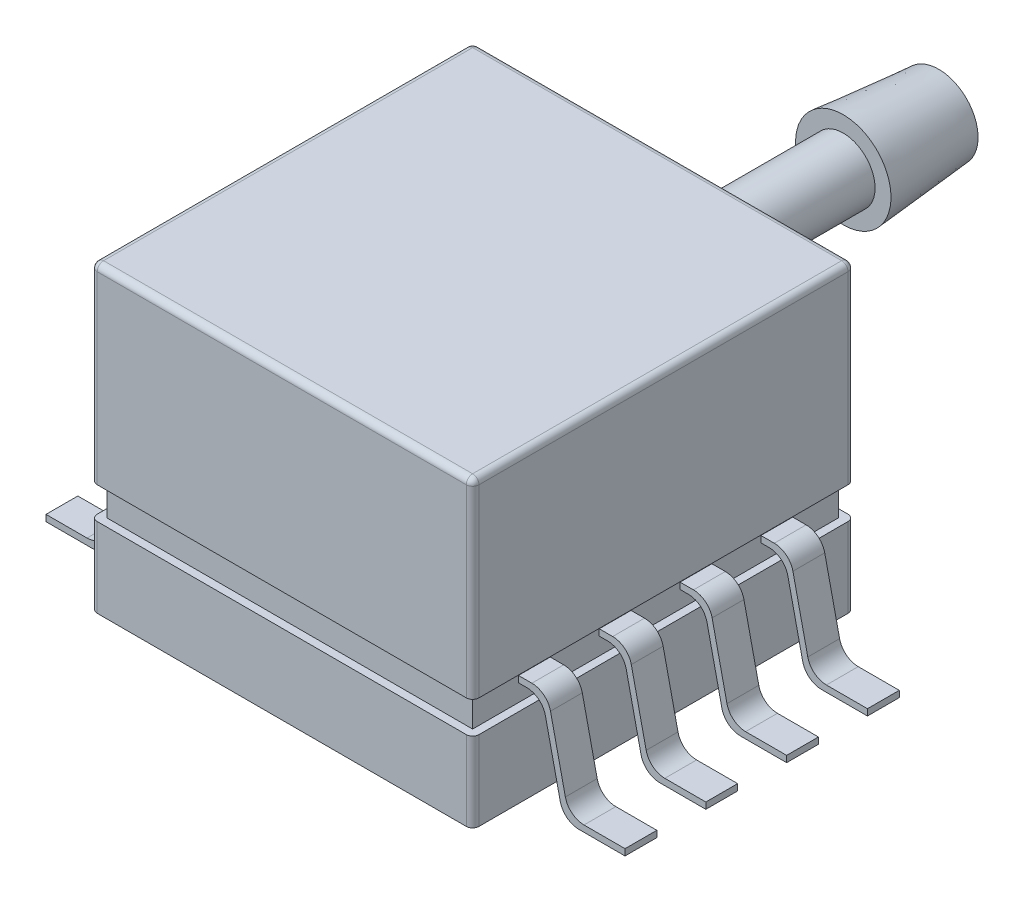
SolidWorks part; units mm, degrees
ref_plane "Plano frontal" through (0, 0, 0) normal (0, 0, 1) x (1, 0, 0)
ref_plane "Plano superior" through (0, 0, 0) normal (0, 1, 0) x (1, 0, 0)
ref_plane "Plano direito" through (0, 0, 0) normal (1, 0, 0) x (0, 0, -1)
sketch "Esboço1" plane through (0, 0, 0) normal (0, 1, 0) x (1, 0, 0)
  line L1 (-5.75, -5.75) -> (5.75, -5.75)
  line L2 (-5.75, -5.75) -> (-5.75, 5.75)
  line L3 (-5.75, 5.75) -> (5.75, 5.75)
  line L4 (5.75, -5.75) -> (5.75, 5.75)
  line L5 (-5.75, -5.75) -> (5.75, 5.75) construction
  line L6 (-5.75, 5.75) -> (5.75, -5.75) construction
  point P0 (0, 0)
  dimension "D1" = 11.5
  dimension "D2" = 11.5
extrude "Ressalto-extrusão1" add sketch "Esboço1" against normal blind 1
ref_plane "Plano1" through (0, 0, 3.81) normal (0, 0, 1) x (1, 0, 0)
sketch "Esboço5" plane through (0, -1, 0) normal (0, -1, 0) x (1, 0, 0)
  line L1 (-6, -6) -> (6, -6)
  line L2 (-6, -6) -> (-6, 6)
  line L3 (-6, 6) -> (6, 6)
  line L4 (6, -6) -> (6, 6)
  line L5 (-6, -6) -> (6, 6) construction
  line L6 (-6, 6) -> (6, -6) construction
  point P0 (0, 0)
  dimension "D1" = 12
  dimension "D2" = 12
extrude "Ressalto-extrusão3" add sketch "Esboço5" along normal blind 2.5
sketch "Esboço4" plane through (0, 0, 3.81) normal (0, 0, 1) x (1, 0, 0)
  line L0 (0, -0.2598) -> (0, -4.5224) construction
  line L2 (-5.0865, -0.2598) -> (-6.1719, -0.2598)
  line L4 (-6.7576, -0.7295) -> (-7.2249, -2.8303)
  line L5 (-7.8106, -3.3) -> (-9.1, -3.3)
  line L6 (-9.1, -3.3) -> (-9.1, -3.5)
  line L7 (-9.1, -3.5) -> (-7.6502, -3.5)
  line L8 (-7.0645, -3.0303) -> (-6.5972, -0.9295)
  line L9 (-6.0115, -0.4598) -> (-5.0865, -0.4598)
  line L11 (-5.0865, -0.4598) -> (-5.0865, -0.2598)
  line L13 (5.0865, -0.4598) -> (5.0865, -0.2598)
  line L14 (6.0115, -0.4598) -> (5.0865, -0.4598)
  line L15 (7.0645, -3.0303) -> (6.5972, -0.9295)
  line L16 (9.1, -3.5) -> (7.6502, -3.5)
  line L17 (9.1, -3.3) -> (9.1, -3.5)
  line L18 (7.8106, -3.3) -> (9.1, -3.3)
  line L19 (6.7576, -0.7295) -> (7.2249, -2.8303)
  line L20 (5.0865, -0.2598) -> (6.1719, -0.2598)
  line L21 (-5.75, 0) -> (5.75, 0) construction
  arc A0 (-7.6502, -3.5) -> (-7.0645, -3.0303) centre (-7.6502, -2.9) ccw
  arc A1 (-7.2249, -2.8303) -> (-7.8106, -3.3) centre (-7.8106, -2.7) cw
  arc A2 (-6.1719, -0.2598) -> (-6.7576, -0.7295) centre (-6.1719, -0.8598) ccw
  arc A3 (-6.5972, -0.9295) -> (-6.0115, -0.4598) centre (-6.0115, -1.0598) cw
  arc A4 (6.5972, -0.9295) -> (6.0115, -0.4598) centre (6.0115, -1.0598) ccw
  arc A5 (6.1719, -0.2598) -> (6.7576, -0.7295) centre (6.1719, -0.8598) cw
  arc A6 (7.2249, -2.8303) -> (7.8106, -3.3) centre (7.8106, -2.7) ccw
  arc A7 (7.6502, -3.5) -> (7.0645, -3.0303) centre (7.6502, -2.9) cw
  dimension "D5" = 0.6
  dimension "D1" = 0.2
  dimension "D2" = 0.2
  dimension "D3" = 0.2
  dimension "D4" = 18.2
  dimension "D6" = 3.5
extrude "Ressalto-extrusão2" add sketch "Esboço4" along normal mid plane 1
pattern_linear "Padrão linear1" count 4 spacing 2.54 along (0, 0, -1) of "Ressalto-extrusão2"
sketch "Esboço6" plane through (0, 0, 0) normal (0, 1, 0) x (1, 0, 0)
  line L1 (-6, -6) -> (6, -6)
  line L2 (-6, -6) -> (-6, 6)
  line L3 (-6, 6) -> (6, 6)
  line L4 (6, -6) -> (6, 6)
  line L5 (-6, -6) -> (6, 6) construction
  line L6 (-6, 6) -> (6, -6) construction
  point P0 (0, 0)
extrude "Ressalto-extrusão4" add sketch "Esboço6" along normal blind 6
fillet "Filete1" radius 0.2 12 edges at (0, 6, 6) (-6, 6, 0) (0, 6, -6) (6, 6, 0) (6, -2.25, 6) (-6, -2.25, 6) (-6, -2.25, -6) (6, -2.25, -6) (-6, 3, -6) (6, 3, -6) (6, 3, 6) (-6, 3, 6)
sketch "Esboço7" plane through (0, 0, -6) normal (0, 0, -1) x (-1, 0, 0)
  line L0 (0, 0) -> (0, 6.9919) construction
  line L1 (5.8, -3.5) -> (-5.8, -3.5) construction
  line L2 (5.8, 5.8) -> (-5.8, 5.8) construction
  circle A0 centre (-2.15, 4.8) radius 1
  circle A1 centre (2.15, -2.5) radius 1
  dimension "D1" = 2
  dimension "D2" = 2
  dimension "D3" = 4.3
  dimension "D4" = 4.3
extrude "Ressalto-extrusão5" add sketch "Esboço7" along normal blind 3.5
sketch "Esboço8" plane through (0, 0, -9.5) normal (0, 0, -1) x (-1, 0, 0)
  circle A0 centre (-2.15, 4.8) radius 1.5
  circle A1 centre (2.15, -2.5) radius 1.5
  dimension "D1" = 3
  dimension "D2" = 3
extrude "Ressalto-extrusão6" add sketch "Esboço8" along normal blind 3 draft 5
sketch "Esboço9" plane through (0, 0, -12.5) normal (0, 0, -1) x (-1, 0, 0)
  circle A0 centre (-2.15, 4.8) radius 0.9
  circle A1 centre (2.15, -2.5) radius 0.9
  dimension "D1" = 1.8
  dimension "D2" = 1.8
extrude "Corte-extrusão1" cut sketch "Esboço9" against normal blind 13
